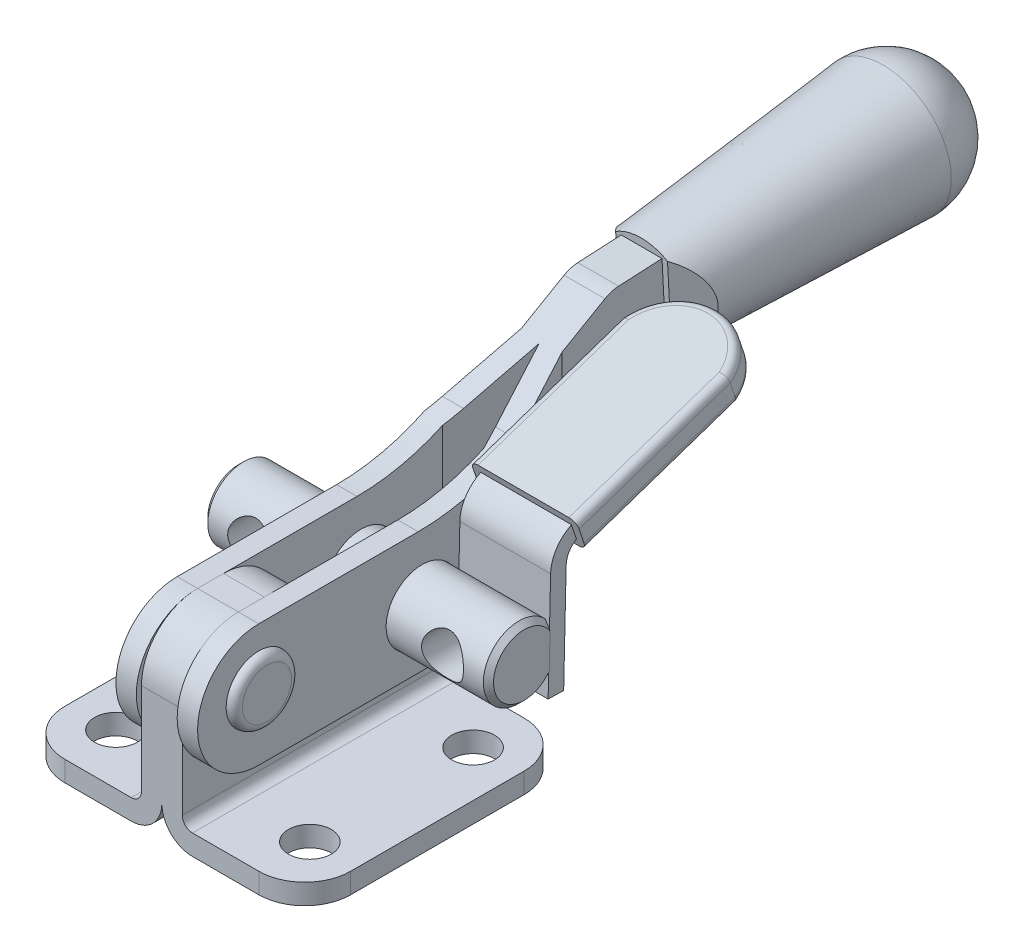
SolidWorks part; units mm, degrees
ref_plane "Front Plane" through (0, 0, 0) normal (0, 0, 1) x (1, 0, 0)
ref_plane "Top Plane" through (0, 0, 0) normal (0, 1, 0) x (1, 0, 0)
ref_plane "Right Plane" through (0, 0, 0) normal (1, 0, 0) x (0, 0, -1)
imported_body "5071A51 - Base-1-solid1"
imported_body "5071A51 - Lever-1-solid1"
imported_body "5071A51 - Handle-1-solid1"
imported_body "5071A51 - Rod-1-solid1"
imported_body "5071A51 - U-Bolt-1-solid1"
imported_body "5071A51 - Nut-1-solid1"
imported_body "5071A51 - Nut-2-solid1"
imported_body "5071A51 - Lock Nut-1-solid1"
imported_body "5071A51 - Lock Nut-2-solid1"
imported_body "5071A51 - Lever 2-1-solid1"
imported_body "5071A51 - Handle 2-1-solid1"
imported_body "5071A51 - Latch-1-solid1"
delete or keep bodies "Body-Delete1" type delete bodies bodies 113 106 108 107 110 109
